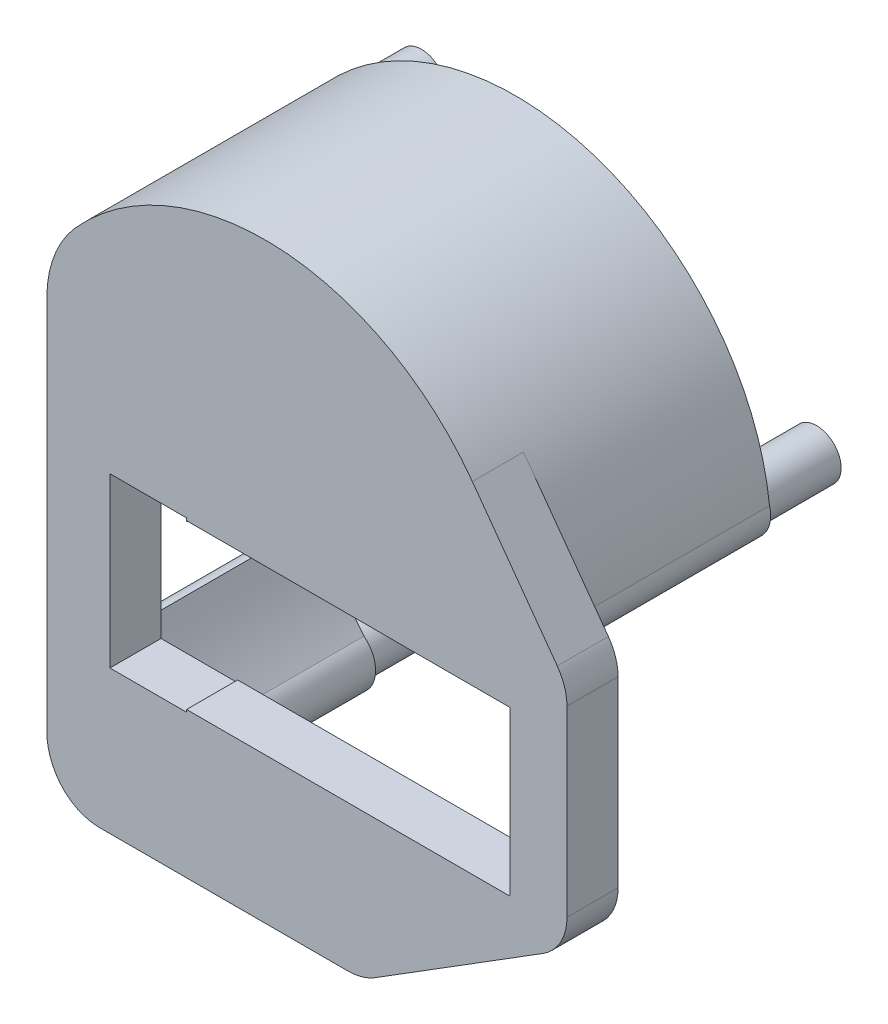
SolidWorks part; units mm, degrees
ref_plane "Front Plane" through (0, 0, 0) normal (0, 0, 1) x (1, 0, 0)
ref_plane "Top Plane" through (0, 0, 0) normal (0, 1, 0) x (1, 0, 0)
ref_plane "Right Plane" through (0, 0, 0) normal (1, 0, 0) x (0, 0, -1)
sketch "Sketch1" plane through (0, 0, 0) normal (0, 0, 1) x (1, 0, 0)
  circle A0 centre (-21.59, 31.8489) radius 3.048
  circle A1 centre (27.5071, 15.8962) radius 3.048
  circle A2 centre (-21.59, -25.3011) radius 3.048
  dimension "D1" = 6.096
extrude "Boss-Extrude1" add sketch "Sketch1" along normal blind 25.4
ref_plane "Plane1" through (0, 0, 12.7) normal (0, 0, -1) x (-1, 0, 0)
sketch "Sketch2" plane through (0, 0, 12.7) normal (0, 0, -1) x (-1, 0, 0)
  arc A0 (-27.5071, 15.8962) -> (21.59, 31.8489) centre (0.4118, 13.4995) cw construction
  arc A1 (23.9596, 34.8323) -> (-31.1778, 16.9171) centre (0.4118, 13.4995) ccw
  arc A2 (19.2204, 28.8654) -> (-23.8364, 14.8754) centre (0.4118, 13.4995) ccw
  arc A4 (-31.1778, 16.9171) -> (-23.8364, 14.8754) centre (-27.5071, 15.8962) ccw
  arc A5 (21.59, 31.8489) -> (21.59, -25.3011) centre (-11.3902, 3.2739) cw construction
  arc A6 (23.9596, -28.2846) -> (23.9596, 34.8323) centre (-11.3902, 3.2739) ccw
  arc A7 (19.2204, -22.3177) -> (19.2204, 28.8654) centre (-11.3902, 3.2739) ccw
  arc A8 (19.2204, -22.3177) -> (23.9596, -28.2846) centre (21.59, -25.3011) ccw
  point P3 (-7.2407, 37.0516)
  point P10 (35.3856, 3.2739)
  dimension "D1" = 3.81
extrude "Boss-Extrude2" add sketch "Sketch2" along normal mid plane 6.35
sketch "Sketch3" plane through (0, 0, 15.875) normal (0, 0, 1) x (1, 0, 0)
  arc A6 (-23.9596, 34.8323) -> (-23.9596, -28.2846) centre (11.3902, 3.2739) ccw
  arc A7 (-23.9596, -28.2846) -> (-19.2204, -22.3177) centre (-21.59, -25.3011) ccw
  arc A8 (-19.2204, 28.8654) -> (-19.2204, -22.3177) centre (11.3902, 3.2739) ccw
  arc A9 (23.8364, 14.8754) -> (-19.2204, 28.8654) centre (-0.4118, 13.4995) ccw
  arc A10 (23.8364, 14.8754) -> (31.1778, 16.9171) centre (27.5071, 15.8962) ccw
  arc A11 (31.1778, 16.9171) -> (-23.9596, 34.8323) centre (-0.4118, 13.4995) ccw
  arc A12 (-23.9596, 34.8323) -> (-23.9596, -28.2846) centre (11.3902, 3.2739) ccw
  arc A13 (-23.9596, -28.2846) -> (-19.2204, -22.3177) centre (-21.59, -25.3011) ccw
  arc A14 (-19.2204, 28.8654) -> (-19.2204, -22.3177) centre (11.3902, 3.2739) ccw
  arc A15 (23.8364, 14.8754) -> (-19.2204, 28.8654) centre (-0.4118, 13.4995) ccw
  arc A16 (23.8364, 14.8754) -> (31.1778, 16.9171) centre (27.5071, 15.8962) ccw
  arc A17 (31.1778, 16.9171) -> (-23.9596, 34.8323) centre (-0.4118, 13.4995) ccw
  dimension "D1" = 0
extrude "Boss-Extrude3" add sketch "Sketch3" along normal up to surface (18.3774 mm away)
sketch "Sketch4" plane through (0, 0, 34.2524) normal (0, 0, 1) x (1, 0, 0)
  line L0 (-20.9917, -28.2846) -> (9.8628, -28.2846)
  line L1 (37.084, -8.8901) -> (37.084, 13.8383)
  line L2 (37.084, -5.1649) -> (37.084, 5.1649) construction
  line L3 (25.3222, 32.1368) -> (35.8769, 17.563)
  line L4 (13.2283, -27.3194) -> (34.0995, -14.2749)
  line L5 (-10.1981, -10.4584) -> (-19.7231, -10.4584)
  line L6 (29.9466, 10.0965) -> (-10.1981, 10.0965)
  line L7 (29.9466, 10.0965) -> (29.9466, -10.16)
  line L8 (29.9466, -10.16) -> (-10.1981, -10.16)
  line L9 (-10.1981, 10.0965) -> (-10.1981, -10.4584)
  line L10 (-19.7231, -10.4584) -> (-19.7231, 10.4584)
  line L11 (-19.7231, 10.4584) -> (3.7564, 10.4584)
  line L12 (-10.1981, 10.4584) -> (-10.1981, -10.16)
  arc A0 (37.084, 13.8383) -> (35.8769, 17.563) centre (30.734, 13.8383) ccw
  arc A1 (34.0995, -14.2749) -> (37.084, -8.8901) centre (30.734, -8.8901) ccw
  arc A2 (13.2283, -27.3194) -> (9.8628, -28.2846) centre (9.8628, -21.9346) cw
  arc A3 (-26.0024, -25.8353) -> (-20.9917, -28.2846) centre (-20.9917, -21.9346) ccw
  arc A6 (-23.9596, 34.8323) -> (-23.9596, -28.2846) centre (11.3902, 3.2739) ccw
  arc A7 (-23.9596, -28.2846) -> (-18.2995, -23.3805) centre (-21.59, -25.3011) ccw
  arc A8 (-19.2204, 28.8654) -> (-18.2995, -23.3805) centre (11.3902, 3.2739) ccw
  arc A9 (23.8364, 14.8754) -> (-19.2204, 28.8654) centre (-0.4118, 13.4995) ccw
  arc A10 (23.8364, 14.8754) -> (31.1778, 16.9171) centre (27.5071, 15.8962) ccw
  arc A11 (31.1778, 16.9171) -> (-23.9596, 34.8323) centre (-0.4118, 13.4995) ccw
  arc A12 (-23.9596, 34.8323) -> (-26.0024, -25.8353) centre (11.3902, 3.2739) ccw
  arc A17 (25.3222, 32.1368) -> (-23.9596, 34.8323) centre (-0.4118, 13.4995) ccw
  point P3 (37.084, -28.2846)
  point P23 (37.084, 15.8962)
  point P26 (37.084, -12.4096)
  point P29 (11.684, -28.2846)
  point P39 (-19.7231, 0)
  dimension "D4" = 6.35
  dimension "D5" = 6.35
  dimension "D2" = 25.4
  dimension "D3" = 15.875
  dimension "D6" = 9.525
  dimension "D1" = 0
extrude "Boss-Extrude4" add sketch "Sketch4" along normal blind 6.35 contours A2 L4 A1 L1 A0 L3 L0 L12 L11 L10 L5 L9 L6 L7 L8 M16 M15 M14 M13 M12 | A3 L0 M11 M12 M13 M14 M15 M16
sketch "Sketch5" plane through (-10.16, 0, 0) normal (-1, 0, 0) x (0, 0, 1)
  line L0 (9.525, 34.8323) -> (40.6024, 34.8323) construction
  line L1 (20.3012, 25.2906) -> (29.8262, 25.2906)
  line L2 (20.3012, 25.2906) -> (20.3012, -12.8094)
  line L3 (20.3012, -12.8094) -> (29.8262, -12.8094)
  line L4 (29.8262, 25.2906) -> (29.8262, -12.8094)
  point P6 (25.0637, 34.8323)
  point P7 (25.0637, 25.2906)
  dimension "D1" = 38.1
  dimension "D2" = 9.525
extrude "Cut-Extrude1" cut sketch "Sketch5" along normal through all
sketch "Sketch6" plane through (0, 0, 40.6024) normal (0, 0, 1) x (1, 0, 0)
  line L0 (-11.4046, 4.7942) -> (-19.6596, 4.7942)
  line L1 (30.0101, 10.16) -> (-10.1346, 10.16)
  line L2 (30.0101, 10.16) -> (30.0101, -10.0965)
  line L3 (30.0101, -10.0965) -> (-10.1346, -10.0965)
  line L4 (-10.1346, 10.16) -> (-10.1346, 6.0642)
  line L5 (-19.6596, 4.7942) -> (-19.6596, -4.7308)
  line L6 (-19.6596, -4.7308) -> (-11.4046, -4.7308)
  line L7 (-10.1346, -6.0008) -> (-10.1346, -10.0965)
  arc A0 (-11.4046, -4.7308) -> (-10.1346, -6.0008) centre (-11.4046, -6.0008) cw
  arc A1 (-11.4046, 4.7942) -> (-10.1346, 6.0642) centre (-11.4046, 6.0642) ccw
  point P12 (-10.1346, -4.7308)
  point P15 (-10.1346, 4.7942)
  dimension "D3" = 1.27
  dimension "D1" = 9.525
  dimension "D2" = 9.525
extrude "Cut-Extrude2" cut sketch "Sketch6" against normal up to next
sketch "Sketch7" plane through (0, 0, 40.6024) normal (0, 0, 1) x (1, 0, 0)
  line L0 (-27.559, 25.4982) -> (-27.559, -21.3016)
  line L1 (-28.575, -32.7127) -> (-28.575, 56.8125) construction
  line L4 (35.8769, 17.563) -> (25.3222, 32.1368)
  line L5 (-20.9917, -28.2846) -> (9.8628, -28.2846)
  line L6 (13.2283, -27.3194) -> (34.0995, -14.2749)
  line L7 (37.084, -8.8901) -> (37.084, 13.8383)
  line L8 (35.8769, 17.563) -> (25.3222, 32.1368)
  line L9 (-20.9917, -28.2846) -> (9.8628, -28.2846)
  line L10 (13.2283, -27.3194) -> (34.0995, -14.2749)
  line L11 (37.084, -8.8901) -> (37.084, 13.8383)
  arc A0 (-23.9596, 34.8323) -> (-27.559, 25.4982) centre (-13.6563, 25.4982) ccw
  arc A1 (-26.0024, -25.8353) -> (-27.559, -21.3016) centre (-20.1786, -21.3016) cw
  arc A6 (25.3222, 32.1368) -> (-23.9596, 34.8323) centre (-0.4118, 13.4995) ccw
  arc A7 (-23.9596, 34.8323) -> (-26.0024, -25.8353) centre (11.3902, 3.2739) ccw
  arc A8 (-26.0024, -25.8353) -> (-20.9917, -28.2846) centre (-20.9917, -21.9346) ccw
  arc A9 (9.8628, -28.2846) -> (13.2283, -27.3194) centre (9.8628, -21.9346) ccw
  arc A10 (34.0995, -14.2749) -> (37.084, -8.8901) centre (30.734, -8.8901) ccw
  arc A11 (37.084, 13.8383) -> (35.8769, 17.563) centre (30.734, 13.8383) ccw
  arc A12 (25.3222, 32.1368) -> (-23.9596, 34.8323) centre (-0.4118, 13.4995) ccw
  arc A13 (-23.9596, 34.8323) -> (-26.0024, -25.8353) centre (11.3902, 3.2739) ccw
  arc A14 (-26.0024, -25.8353) -> (-20.9917, -28.2846) centre (-20.9917, -21.9346) ccw
  arc A15 (9.8628, -28.2846) -> (13.2283, -27.3194) centre (9.8628, -21.9346) ccw
  arc A16 (34.0995, -14.2749) -> (37.084, -8.8901) centre (30.734, -8.8901) ccw
  arc A17 (37.084, 13.8383) -> (35.8769, 17.563) centre (30.734, 13.8383) ccw
  dimension "D2" = 1.016
  dimension "D1" = 0
extrude "Cut-Extrude3" cut sketch "Sketch7" against normal through all contours A1 L0 A0 M26
sketch "Sketch8" plane through (0, 0, 20.3012) normal (0, 0, 1) x (1, 0, 0)
  line L2 (-21.8844, 25.2906) -> (-27.559, 25.2906)
  line L3 (-27.559, 25.2906) -> (-27.559, 11.928)
  line L4 (-21.8844, 25.2906) -> (-27.559, 25.2906)
  line L5 (-27.559, 25.2906) -> (-27.559, 11.928)
  line L6 (-27.559, -5.3803) -> (-27.559, -12.8094)
  line L7 (-27.559, -12.8094) -> (-25.1237, -12.8094)
  line L8 (-27.559, -5.3803) -> (-27.559, -12.8094)
  line L9 (-27.559, -12.8094) -> (-25.1237, -12.8094)
  arc A1 (-21.8844, 25.2906) -> (-27.559, 11.928) centre (11.3902, 3.2739) ccw
  arc A2 (-21.8844, 25.2906) -> (-27.559, 11.928) centre (11.3902, 3.2739) ccw
  arc A3 (-27.559, -5.3803) -> (-25.1237, -12.8094) centre (11.3902, 3.2739) ccw
  arc A4 (-27.559, -5.3803) -> (-25.1237, -12.8094) centre (11.3902, 3.2739) ccw
  dimension "D1" = 0
  dimension "D2" = 0
extrude "Cut-Extrude4" cut sketch "Sketch8" against normal through all
fillet "Fillet1" radius 2.54 2 edges at (-27.559, -12.8094, 19.6756) (-27.559, 25.2906, 19.6756)
